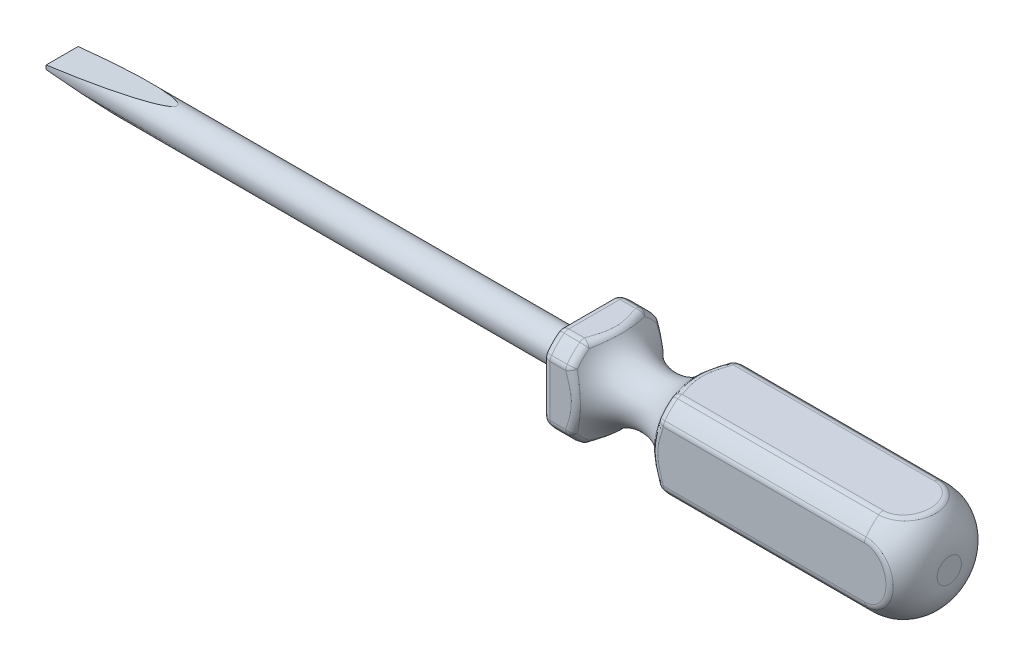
SolidWorks part; units mm, degrees
ref_plane "Front Plane" through (0, 0, 0) normal (0, 0, 1) x (1, 0, 0)
ref_plane "Top Plane" through (0, 0, 0) normal (0, 1, 0) x (1, 0, 0)
ref_plane "Right Plane" through (0, 0, 0) normal (1, 0, 0) x (0, 0, -1)
sketch "Sketch1" plane through (0, 0, 0) normal (0, 0, 1) x (1, 0, 0)
  line L0 (0, 0) -> (-139.7, 0)
  line L1 (-139.7, 0) -> (-139.7, 2.54)
  line L2 (-139.7, 2.54) -> (-57.15, 2.54)
  line L3 (-57.15, 2.54) -> (-57.15, 6.985)
  line L4 (-55.88, 8.255) -> (-53.419, 8.255)
  line L5 (0, 1.905) -> (0, 0)
  line L6 (-38.021, 8.255) -> (-6.35, 8.255)
  arc A0 (-52.3191, 7.62) -> (-39.1209, 7.62) centre (-45.72, 11.43) ccw
  arc A1 (-38.021, 8.255) -> (-39.1209, 7.62) centre (-38.021, 6.985) ccw
  arc A2 (-52.3191, 7.62) -> (-53.419, 8.255) centre (-53.419, 6.985) ccw
  arc A3 (-55.88, 8.255) -> (-57.15, 6.985) centre (-55.88, 6.985) ccw
  arc A4 (0, 1.905) -> (-6.35, 8.255) centre (-6.35, 1.905) ccw
  dimension "D7" = 7.62
  dimension "D8" = 1.27
  dimension "D9" = 6.35
  dimension "D1" = 139.7
  dimension "D2" = 2.54
  dimension "D3" = 8.255
  dimension "D4" = 57.15
  dimension "D5" = 45.72
  dimension "D6" = 11.43
revolve "Revolve1" add sketch "Sketch1" angle 360 about L0
sketch "Sketch2" plane through (0, 0, 0) normal (0, 0, 1) x (1, 0, 0)
  line L0 (-139.7, 2.54) -> (-139.7, 0.3175)
  line L1 (-139.7, 2.54) -> (-121.5992, 2.54)
  line L2 (-57.15, 2.54) -> (-139.7, 2.54) construction
  line L3 (-121.5992, 2.54) -> (-139.7, 0.3175)
  line L4 (-139.7, -2.54) -> (-121.5992, -2.54)
  line L5 (-139.7, -2.54) -> (-57.15, -2.54) construction
  line L6 (-121.5992, -2.54) -> (-139.7, -0.3175)
  line L7 (-139.7, 0) -> (0, 0) construction
  line L8 (-139.7, -0.3175) -> (-139.7, -2.54)
  dimension "D1" = 0.635
  dimension "D2" = 7
extrude "Cut-Extrude1" cut sketch "Sketch2" against normal through all and the other way through all
sketch "Sketch3" plane through (0, 0, 0) normal (1, 0, 0) x (0, 0, -1)
  line L0 (0, 0) -> (10.9973, 0) construction
  line L1 (0, 0) -> (0, 10.9973) construction
  line L2 (0, 0) -> (0, -10.9973) construction
  line L3 (0, 0) -> (-10.9973, 0) construction
  line L4 (-6.35, 10.16) -> (-6.35, 6.985)
  line L5 (-6.35, 10.16) -> (6.35, 10.16)
  line L6 (6.35, 10.16) -> (6.35, 6.985)
  line L7 (6.35, 6.985) -> (-6.35, 6.985)
  line L8 (6.35, -10.16) -> (6.35, -6.985)
  line L9 (-10.16, 6.35) -> (-10.16, -6.35)
  line L10 (10.16, 6.35) -> (6.985, 6.35)
  line L11 (10.16, 6.35) -> (10.16, -6.35)
  line L12 (10.16, -6.35) -> (6.985, -6.35)
  line L13 (6.985, 6.35) -> (6.985, -6.35)
  line L14 (-10.16, 6.35) -> (-6.985, 6.35)
  line L15 (-6.985, 6.35) -> (-6.985, -6.35)
  line L16 (-10.16, -6.35) -> (-6.985, -6.35)
  line L17 (6.35, -6.985) -> (-6.35, -6.985)
  line L18 (-6.35, -10.16) -> (6.35, -10.16)
  line L19 (-6.35, -10.16) -> (-6.35, -6.985)
  dimension "D1" = 12.7
  dimension "D2" = 6.985
  dimension "D3" = 10.16
  dimension "D4" = 6.985
extrude "Cut-Extrude2" cut sketch "Sketch3" against normal up to surface (57.15 mm away)
fillet "Fillet1" radius 1.27 52 edges at (-38.6274, 6.985, -4.1029) (-38.5922, 6.985, 4.1392) (-38.6274, -4.1029, -6.985) (-38.5922, 4.1392, -6.985) (-56.4864, 6.985, -4.1029) (-55.2276, 6.985, -4.0509) (-56.4864, -4.1029, -6.985) (-55.2276, -4.0509, -6.985) (-54.6495, 6.985, -4.3994) (-54.6495, 6.985, 4.3994) (-54.6495, -4.3994, -6.985) (-54.6495, 4.3994, -6.985) (-52.8478, 6.985, -4.1392) (-52.8126, 6.985, 4.1029) (-52.8126, 4.1029, -6.985) (-52.8478, -4.1392, -6.985) (-22.1855, 6.985, -4.3994) (-22.1855, 6.985, 4.3994) (-22.1855, -4.3994, -6.985) (-22.1855, 4.3994, -6.985) (-38.6274, -6.985, 4.1029) (-38.5922, -6.985, -4.1392) (-22.1855, -6.985, 4.3994) (-22.1855, -6.985, -4.3994) (-52.8478, -6.985, 4.1392) (-52.8126, -6.985, -4.1029) (-54.6495, -6.985, 4.3994) (-54.6495, -6.985, -4.3994) (-56.4864, -6.985, 4.1029) (-55.2276, -6.985, 4.0509) (-52.8478, 4.1392, 6.985) (-52.8126, -4.1029, 6.985) (-56.4864, 4.1029, 6.985) (-55.2276, 4.0509, 6.985) (-54.6495, 4.3994, 6.985) (-54.6495, -4.3994, 6.985) (-38.6274, 4.1029, 6.985) (-38.5922, -4.1392, 6.985) (-22.1855, 4.3994, 6.985) (-22.1855, -4.3994, 6.985) (-10.137, 6.985, -0.4896) (-10.137, -0.4896, -6.985) (-10.137, -6.985, 0.4896) (-10.137, 0.4896, 6.985)
